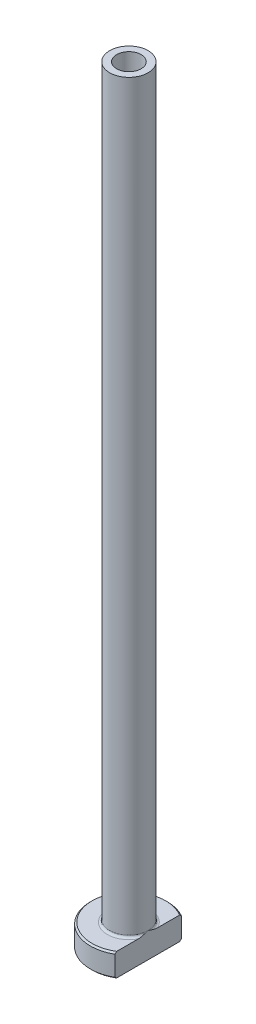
SolidWorks part; units mm, degrees
ref_plane "Front Plane" through (0, 0, 0) normal (0, 0, 1) x (1, 0, 0)
ref_plane "Top Plane" through (0, 0, 0) normal (0, 1, 0) x (1, 0, 0)
ref_plane "Right Plane" through (0, 0, 0) normal (1, 0, 0) x (0, 0, -1)
sketch "Sketch1" plane through (0, 0, 0) normal (0, 0, 1) x (1, 0, 0)
  line L0 (-1.6, 100) -> (-2.5, 100)
  line L1 (-2.5, 100) -> (-2.5, 3)
  line L2 (-2.5, 3) -> (-5, 3)
  line L3 (-5, 3) -> (-5, 0)
  line L4 (3.3, 0) -> (-3.3, 0) construction
  line L5 (-5, 0) -> (-1.85, 0)
  line L6 (-1.6, 55) -> (-1.6, 100)
  line L7 (0, 92.1877) -> (0, -15.5353) construction
  line L8 (0, -4.4) -> (0, 4.4) construction
  line L9 (-1.6, 55) -> (-1.85, 43)
  line L10 (-1.85, 43) -> (-1.85, 0)
  dimension "D1" = 0.25
  dimension "ID" = 3.2
  dimension "OD" = 5
  dimension "L" = 100
  dimension "H" = 10
  dimension "T" = 3
  dimension "N" = 45
  dimension "D2" = 12
  dimension "L-N" = 55
revolve "Revolve1" add sketch "Sketch1" angle 360 about L7
fillet "Fillet1" radius 0.3 1 edges at (0, 3, 2.5)
chamfer "Chamfer1" distance 0.2 angle 45 2 edges at (0, 3, 5) (0, 0, 5)
sketch "Sketch2" plane through (0, 0, 0) normal (0, -1, 0) x (1, 0, 0)
  line L0 (2.5, 4.3301) -> (2.5, -4.3301)
  circle A0 centre (0, 0) radius 5 construction
  arc A1 (2.5, 4.3301) -> (2.5, -4.3301) centre (0, 0) cw
  circle A2 centre (0, 0) radius 2.5 construction
extrude "Cut-Extrude1" cut sketch "Sketch2" against normal through all
chamfer "Chamfer2" distance 0.5 angle 45 1 edges at (0, 0, 1.85)
